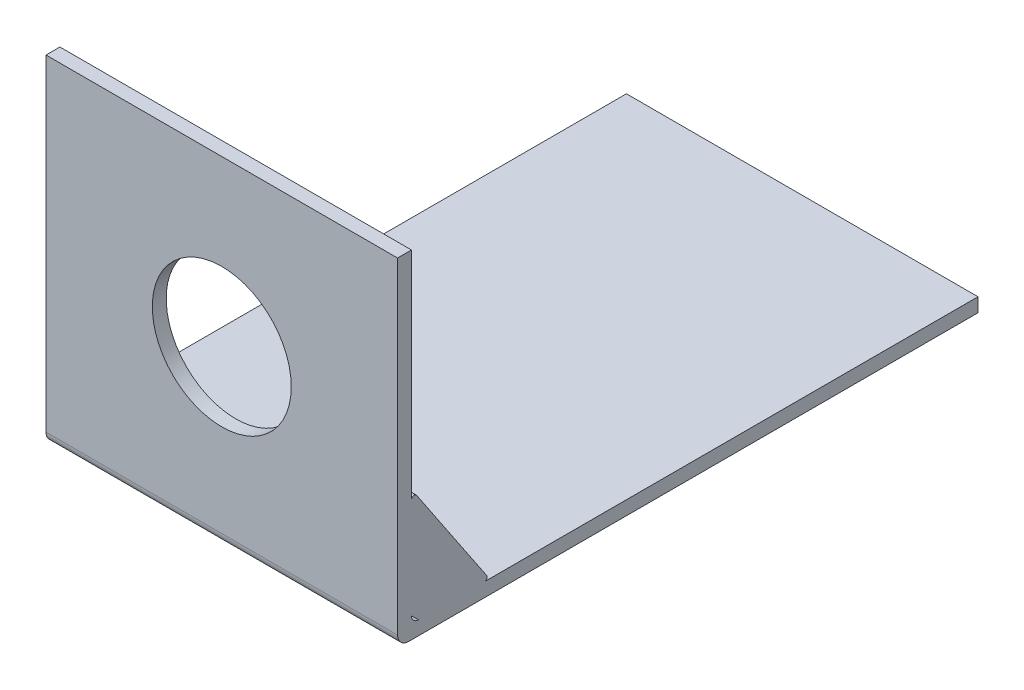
SolidWorks part; units mm, degrees
ref_plane "Front Plane" through (0, 0, 0) normal (0, 0, 1) x (1, 0, 0)
ref_plane "Top Plane" through (0, 0, 0) normal (0, 1, 0) x (1, 0, 0)
ref_plane "Right Plane" through (0, 0, 0) normal (1, 0, 0) x (0, 0, -1)
sketch "Sketch3" plane through (0, 0, 0) normal (1, 0, 0) x (0, 0, -1)
  line L4 (0, -59.69) -> (0, 0)
  line L5 (2.032, -61.722) -> (106.0958, -61.722)
  line L6 (0, 0) -> (2.54, 0)
  line L7 (2.54, 0) -> (2.54, -57.912)
  line L8 (106.0958, -61.722) -> (106.0958, -59.182)
  line L9 (106.0958, -59.182) -> (3.81, -59.182)
  arc A1 (3.81, -59.182) -> (2.54, -57.912) centre (3.81, -57.912) cw
  arc A2 (2.032, -61.722) -> (0, -59.69) centre (2.032, -59.69) cw
  point P1 (0, -56.847)
  point P3 (0.1575, -59.182)
  point P5 (0, -59.2144)
  point P9 (0, 0)
  point P11 (0, 0)
  point P13 (0, 0)
  point P16 (0, -59.166)
  point P17 (0, 0)
  dimension "D7" = 1.27
  dimension "D3" = 59.182
  dimension "D2" = 2.032
  dimension "D1" = 103.5558
  dimension "D5" = 2.54
  dimension "D6" = 2.54
extrude "Boss-Extrude1" add sketch "Sketch3" against normal blind 64.262
sketch "Sketch4" plane through (0, 0, 0) normal (1, 0, 0) x (0, 0, -1)
  line L0 (3.81, -59.182) -> (15.8724, -59.182)
  line L1 (106.0958, -59.182) -> (3.81, -59.182) construction
  line L2 (2.54, -57.912) -> (2.54, -39.5547)
  line L3 (2.54, 0) -> (2.54, -57.912) construction
  line L4 (2.54, -57.912) -> (3.81, -59.182)
  line L5 (3.4552, -39.2762) -> (16.2877, -58.4034)
  arc A0 (2.54, -39.5547) -> (3.4552, -39.2762) centre (3.04, -39.5547) cw
  arc A1 (15.8724, -59.182) -> (16.2877, -58.4034) centre (15.8724, -58.682) ccw
  point P12 (2.54, -37.912)
  point P15 (16.81, -59.182)
  dimension "D3" = 0.5
  dimension "D4" = 0.5
  dimension "D1" = 13
  dimension "D2" = 20
extrude "Boss-Extrude2" add sketch "Sketch4" against normal blind 2.54
ref_plane "Plane1" through (-32.131, 0, 0) normal (1, 0, 0) x (0, 0, -1)
mirror "Mirror1" about plane through (-32.131, 0, 0) normal (1, 0, 0) of "Boss-Extrude2"
sketch "Sketch6" plane through (0, 0, 0) normal (0, 0, 1) x (1, 0, 0)
  line L0 (-32.131, -59.69) -> (-32.131, -30.099) construction
  line L1 (-64.262, -59.69) -> (0, -59.69) construction
  circle A0 centre (-32.131, -30.099) radius 12.7
  dimension "D2" = 25.4
  dimension "D1" = 29.591
extrude "Cut-Extrude2" cut sketch "Sketch6" against normal up to next
